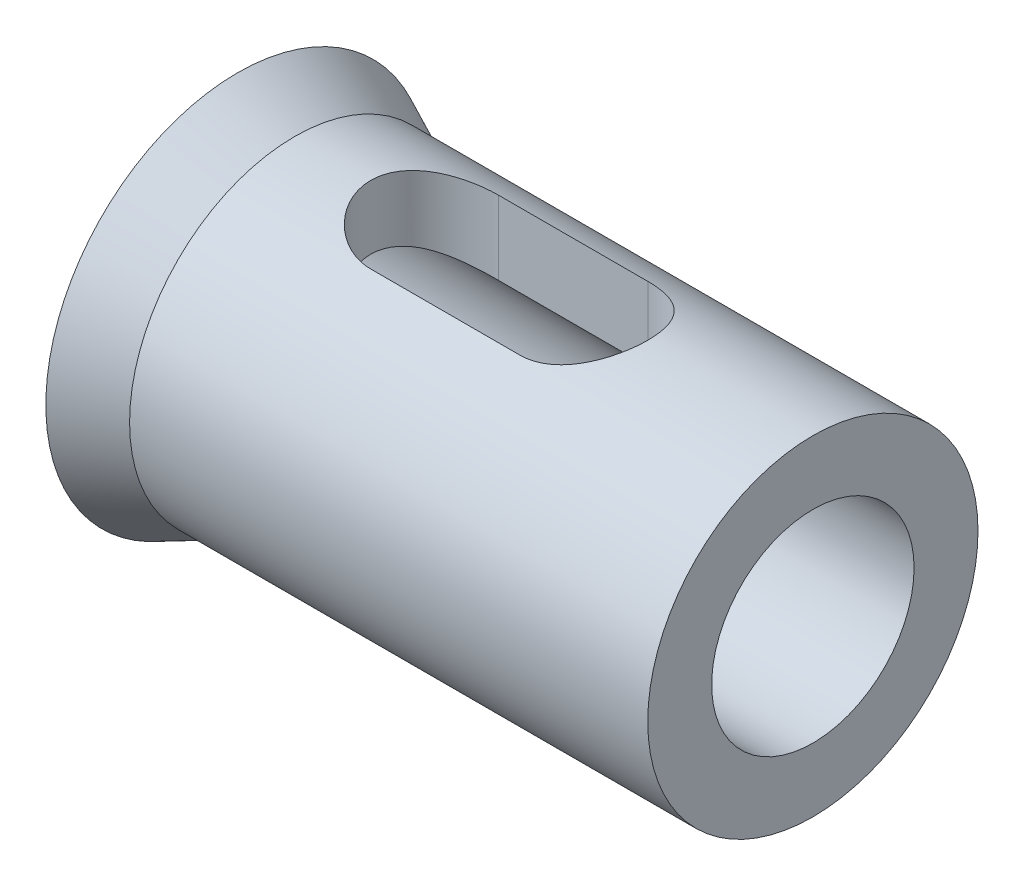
SolidWorks part; units mm, degrees
ref_plane "Přední rovina" through (0, 0, 0) normal (0, 0, 1) x (1, 0, 0)
ref_plane "Horní rovina" through (0, 0, 0) normal (0, 1, 0) x (1, 0, 0)
ref_plane "Pravá rovina" through (0, 0, 0) normal (1, 0, 0) x (0, 0, -1)
sketch "Skica1" plane through (0, 0, 0) normal (0, 0, 1) x (1, 0, 0)
  line L0 (0, 0) -> (0, 9)
  line L1 (0, 9) -> (2.6806, 7.75)
  line L2 (2.6806, 7.75) -> (27, 7.75)
  line L3 (27, 7.75) -> (27, 0)
  line L4 (27, 0) -> (0, 0)
  dimension "D1" = 9
  dimension "D2" = 7.75
  dimension "D3" = 27
  dimension "D4" = 65
revolve "Rotovat1" add sketch "Skica1" angle 360 about L4
hole_wizard "Ø9.5 (9.5) průměr díry1" positions "Skica3" profile "Skica2" hole size "Ø9.5" standard "ANSI Metric"
sketch "Skica3" plane through (27, 0, 0) normal (1, 0, 0) x (0, 0, -1)
  point P0 (0, 0)
sketch "Skica2" plane through (27, 0, 0) normal (0, 1, 0) x (0, 0, -1)
  line L0 (0, 0) -> (0, 27)
  line L1 (0, 27) -> (4.75, 27)
  line L2 (4.75, 27) -> (4.75, 0)
  line L5 (4.75, 0) -> (0, 0)
  line L11 (0, -6.35) -> (0, 107.95) construction
  dimension "Průměr díry skrz" = 9.5
  dimension "Hloubka díry skrz" = 27
sketch "Skica5" plane through (0, 0, 0) normal (0, 1, 0) x (1, 0, 0)
  line L0 (0, 0) -> (12.75, 0) construction
  line L1 (9.25, 0) -> (16.25, 0) construction
  line L2 (9.25, 3) -> (16.25, 3)
  line L3 (9.25, -3) -> (16.25, -3)
  line L4 (0, 4.75) -> (0, -4.75) construction
  arc A0 (9.25, 3) -> (9.25, -3) centre (9.25, 0) ccw
  arc A1 (16.25, -3) -> (16.25, 3) centre (16.25, 0) ccw
  point P5 (12.75, 0)
  dimension "D1" = 3
  dimension "D2" = 9.25
  dimension "D3" = 7
extrude "Odebrat vysunutím1" cut sketch "Skica5" against normal through all and the other way through all
